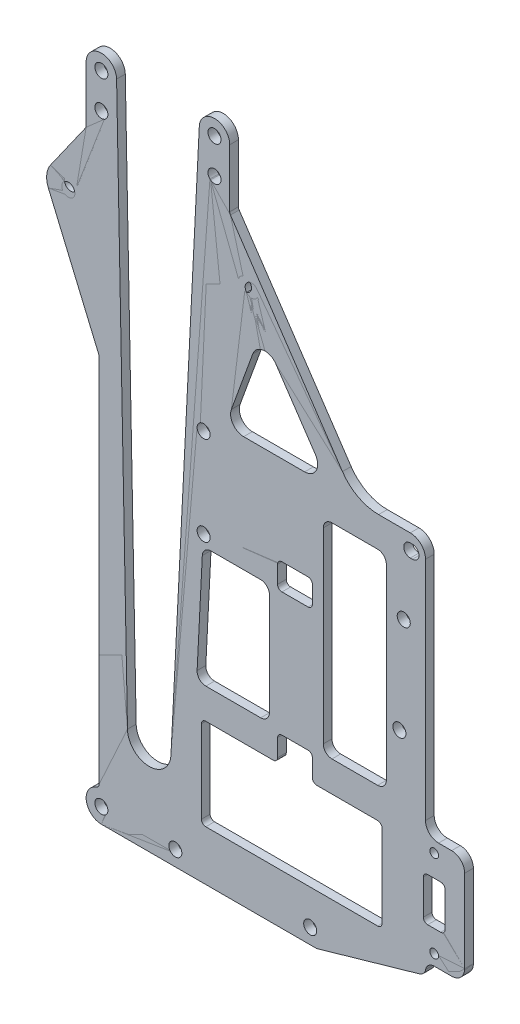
SolidWorks part; units mm, degrees
ref_plane "Plan1" through (0, 0, 0) normal (0, 0, 1) x (1, 0, 0)
ref_plane "Plan2" through (0, 0, 0) normal (0, 1, 0) x (1, 0, 0)
ref_plane "Plan3" through (0, 0, 0) normal (1, 0, 0) x (0, 0, -1)
imported_body "Importée1"
sketch "Esquisse1" plane through (0, 0, 0) normal (0, 0, 1) x (1, 0, 0)
  circle A0 centre (5.0467, 116.1758) radius 1.5 construction
  circle A1 centre (5.0467, 116.1758) radius 1.5
  circle A2 centre (-37.0862, 115.1937) radius 1.5 construction
  circle A3 centre (-37.0862, 115.1937) radius 1.5
extrude "Extrusion1" add sketch "Esquisse1" against normal up to surface
sketch "Esquisse2" plane through (0, 0, 0) normal (0, 0, 1) x (1, 0, 0)
  circle A0 centre (-36.5, 116.6758) radius 1.5 construction
  circle A1 centre (3.5, 116.6758) radius 1.5 construction
  circle A2 centre (-36.5, 116.6758) radius 1.5
  circle A3 centre (3.5, 116.6758) radius 1.5
extrude "Enlèv. mat.-Extru.1" cut sketch "Esquisse2" against normal up to surface
